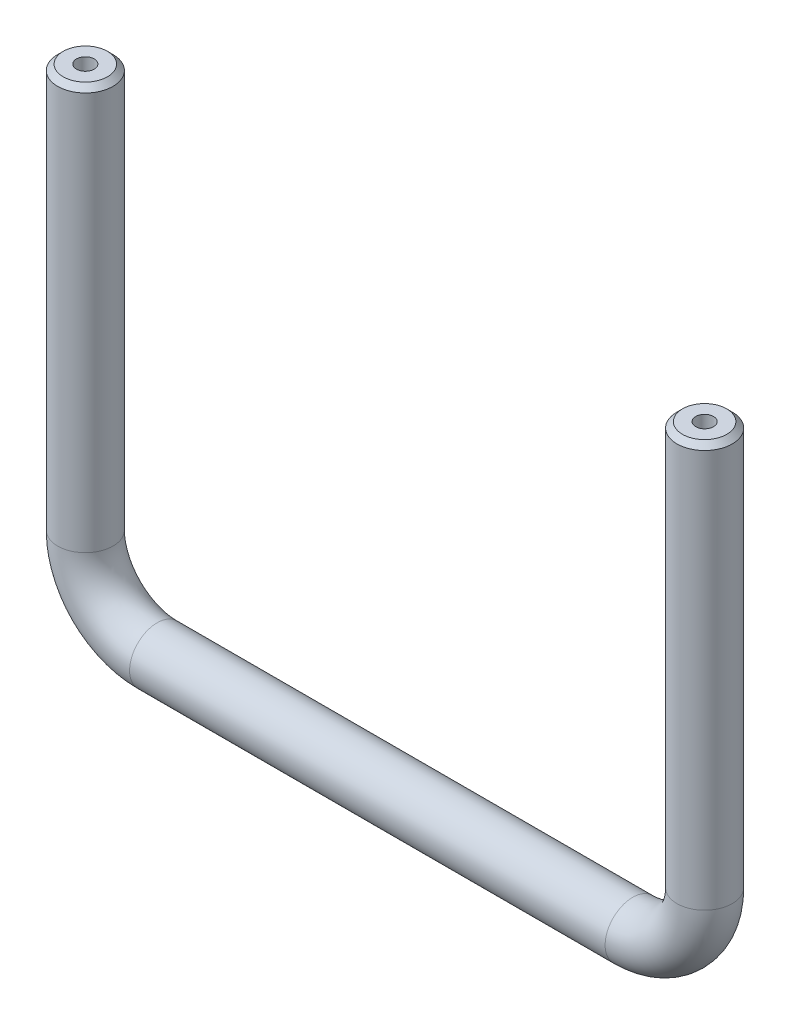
SolidWorks part; units mm, degrees
ref_plane "Front Plane" through (0, 0, 0) normal (0, 0, 1) x (1, 0, 0)
ref_plane "Top Plane" through (0, 0, 0) normal (0, 1, 0) x (1, 0, 0)
ref_plane "Right Plane" through (0, 0, 0) normal (1, 0, 0) x (0, 0, -1)
sketch "Sketch1" plane through (0, 0, 0) normal (0, 0, 1) x (1, 0, 0)
  line L0 (-88.9, 136.525) -> (-88.9, 20.6375)
  line L1 (-68.2625, 0) -> (68.2625, 0)
  line L2 (88.9, 20.6375) -> (88.9, 136.525)
  arc A0 (-88.9, 20.6375) -> (-68.2625, 0) centre (-68.2625, 20.6375) ccw
  arc A1 (68.2625, 0) -> (88.9, 20.6375) centre (68.2625, 20.6375) ccw
  point P4 (0, 0)
  point P8 (-88.9, 0)
  point P11 (88.9, 0)
  dimension "D3" = 20.6375
  dimension "D1" = 177.8
  dimension "D2" = 136.525
ref_plane "Plane1" through (-88.9, 136.525, 0) normal (0, -1, 0) x (-1, 0, 0)
sketch "Sketch2" plane through (-88.9, 136.525, 0) normal (0, -1, 0) x (-1, 0, 0)
  circle A0 centre (0, 0) radius 7.9375
  dimension "D1" = 15.875
sweep "Sweep1" add profiles "Sketch2" path "Sketch1"
chamfer "Chamfer1" distance 1.5875 angle 45 2 edges at (80.9625, 136.525, 0) (-80.9625, 136.525, 0)
hole_wizard "1/4-20 Tapped Hole1" positions "Sketch4" profile "Sketch3" tap size "1/4-20" standard "ANSI Inch"
sketch "Sketch4" plane through (0, 136.525, 0) normal (0, 1, 0) x (1, 0, 0)
  point P0 (-88.9, 0)
  point P3 (88.9, 0)
sketch "Sketch3" plane through (-88.9, 136.525, 0) normal (1, 0, 0) x (0, 0, 1)
  line L0 (0, 0) -> (0, 26.9338)
  line L1 (0, 26.9338) -> (2.5527, 25.4)
  line L2 (2.5527, 25.4) -> (2.5527, 0)
  line L5 (2.5527, 0) -> (0, 0)
  line L10 (0, 26.9338) -> (-2.5527, 25.4) construction
  line L11 (0, -6.35) -> (0, 107.95) construction
  dimension "Tap Drill Dia." = 5.1054
  dimension "Tap Drill Depth" = 25.4
  dimension "Drill Angle" = 118
